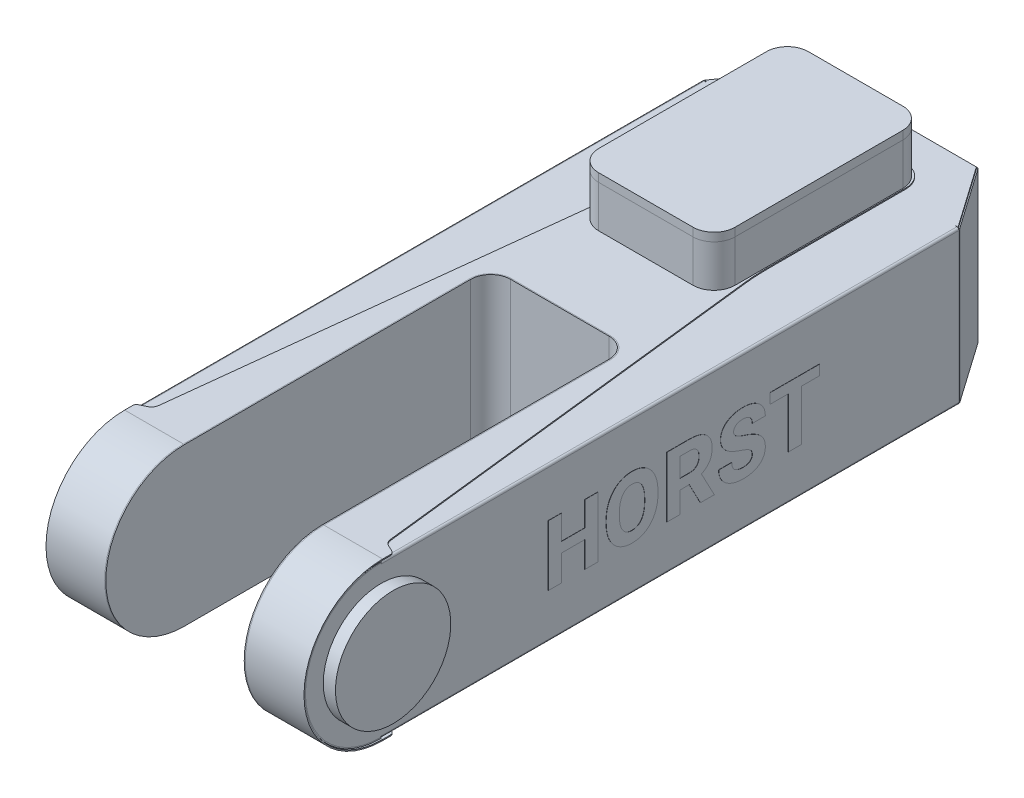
SolidWorks part; units mm, degrees
ref_plane "Ebene vorne" through (0, 0, 0) normal (0, 0, 1) x (1, 0, 0)
ref_plane "Ebene oben" through (0, 0, 0) normal (0, 1, 0) x (1, 0, 0)
ref_plane "Ebene rechts" through (0, 0, 0) normal (1, 0, 0) x (0, 0, -1)
imported_body "Zusammenbau_Einheit82-1/Platte82-1-surface1"
imported_body "Zusammenbau_Einheit82-3/Platte82-1-surface1"
imported_body "Zusammenbau_Treiberbox3-1/Platte165-1-surface1"
imported_body "Zusammenbau_Treiberbox3-1/Abdeckung54-1-surface1"
imported_body "190911_009_B-1-surface1"
imported_body "190911_009_B-1-surface2"
imported_body "190911_010_B-1-surface1"
imported_body "190911_010_B-1-surface2"
imported_body "190911_011_B-1-surface1"
imported_body "190911_011_B-1-surface2"
imported_body "190911_012_B-1-surface1"
sketch "Skizze1" plane through (61.2, 0, 0) normal (1, 0, 0) x (0, 0, -1)
  line L0 (-146.1573, -50.7217) -> (-152.3183, -39.0842)
  line L1 (-157.906, -21.8883) -> (-168.7653, -21.8883)
  line L2 (-168.7653, -21.8883) -> (-168.7653, -50.7217)
  line L3 (-168.7653, -50.7217) -> (-162.5633, -50.7217)
  line L4 (-162.5633, -50.7217) -> (-162.5633, -40.6113)
  line L5 (-162.5633, -40.6113) -> (-158.0815, -40.6113)
  line L6 (-158.0815, -40.6113) -> (-152.7923, -50.7217)
  line L7 (-152.7923, -50.7217) -> (-146.1573, -50.7217)
  line L8 (-173.0365, -36.9369) -> (-173.0365, -35.6907)
  line L9 (-197.6982, -35.6907) -> (-197.6982, -36.9369)
  line L10 (-201.7294, -21.8883) -> (-207.9139, -21.8883)
  line L11 (-207.9139, -21.8883) -> (-207.9139, -33.5726)
  line L12 (-207.9139, -33.5726) -> (-219.1067, -33.5726)
  line L13 (-219.1067, -33.5726) -> (-219.1067, -21.8883)
  line L14 (-219.1067, -21.8883) -> (-225.3087, -21.8883)
  line L15 (-225.3087, -21.8883) -> (-225.3087, -50.7217)
  line L16 (-225.3087, -50.7217) -> (-219.1067, -50.7217)
  line L17 (-219.1067, -50.7217) -> (-219.1067, -38.3646)
  line L18 (-219.1067, -38.3646) -> (-207.9139, -38.3646)
  line L19 (-207.9139, -38.3646) -> (-207.9139, -50.7217)
  line L20 (-207.9139, -50.7217) -> (-201.7294, -50.7217)
  line L21 (-201.7294, -50.7217) -> (-201.7294, -21.8883)
  line L22 (-95.9388, -26.6803) -> (-95.9388, -21.8883)
  line L23 (-95.9388, -21.8883) -> (-119.518, -21.8883)
  line L24 (-119.518, -21.8883) -> (-119.518, -26.6803)
  line L25 (-119.518, -26.6803) -> (-110.8879, -26.6803)
  line L26 (-110.8879, -26.6803) -> (-110.8879, -50.7217)
  line L27 (-110.8879, -50.7217) -> (-104.7093, -50.7217)
  line L28 (-104.7093, -50.7217) -> (-104.7093, -26.6803)
  line L29 (-104.7093, -26.6803) -> (-95.9388, -26.6803)
  line L30 (-137.8314, -41.5826) -> (-144.051, -41.5826)
  line L31 (-128.0194, -30.3312) -> (-121.8409, -30.3312)
  line L32 (-162.5633, -26.6803) -> (-162.5633, -35.8194)
  line L33 (-157.906, -26.6803) -> (-162.5633, -26.6803)
  line L34 (-162.5633, -35.8194) -> (-157.906, -35.8194)
  line L35 (-179.3145, -36.9194) -> (-179.3145, -35.6556)
  line L36 (-191.4201, -35.6556) -> (-191.4201, -36.9194)
  spline S0 degree 3 poles (-152.3183, -39.0842) (-152.1183, -38.9849) (-151.7226, -38.7883) (-151.1568, -38.462) (-150.6262, -38.1096) (-150.133, -37.7287) (-149.6775, -37.318) (-149.2542, -36.8866) (-148.8722, -36.4244) (-148.5194, -35.9408) (-148.2056, -35.4213) (-147.9392, -34.8655) (-147.7086, -34.2755) (-147.5208, -33.6497) (-147.385, -32.9851) (-147.2758, -32.2885) (-147.2208, -31.5549) (-147.2101, -31.0549) (-147.2046, -30.7993) knots 0 0 0 0 0.064592 0.127782 0.188807 0.248729 0.307857 0.366106 0.423388 0.481169 0.539125 0.598674 0.65923 0.722238 0.787412 0.855312 0.926059 1 1 1 1
  spline S1 degree 3 poles (-147.2046, -30.7993) (-147.2068, -30.5651) (-147.2111, -30.1035) (-147.2805, -29.4259) (-147.3776, -28.7728) (-147.5158, -28.1481) (-147.7017, -27.5538) (-147.9131, -26.9826) (-148.1822, -26.4449) (-148.4774, -25.9269) (-148.8182, -25.4446) (-149.188, -24.9874) (-149.6019, -24.5678) (-150.0412, -24.1695) (-150.5238, -23.8096) (-151.0367, -23.4789) (-151.5829, -23.1697) (-152.3746, -22.8124) (-153.4398, -22.426) (-154.8282, -22.1192) (-156.3283, -21.9216) (-157.369, -21.8997) (-157.906, -21.8883) knots 0 0 0 0 0.044443 0.087583 0.129159 0.169759 0.208875 0.247312 0.28523 0.322887 0.360377 0.397211 0.43439 0.472148 0.50969 0.548509 0.587958 0.628711 0.713264 0.802537 0.898103 1 1 1 1
  spline S2 degree 3 poles (-173.0365, -35.6907) (-173.0404, -35.3375) (-173.048, -34.6401) (-173.1271, -33.6131) (-173.2492, -32.6191) (-173.4187, -31.6601) (-173.6328, -30.7328) (-173.9042, -29.8429) (-174.2182, -28.9852) (-174.5878, -28.168) (-174.9986, -27.3899) (-175.4395, -26.651) (-175.9277, -25.9631) (-176.4578, -25.3256) (-177.0162, -24.7247) (-177.6254, -24.1802) (-178.2656, -23.6756) (-178.9475, -23.2268) (-179.6555, -22.8213) (-180.3935, -22.4676) (-181.1633, -22.1794) (-181.9526, -21.929) (-182.7711, -21.744) (-183.615, -21.6074) (-184.4874, -21.5336) (-185.0776, -21.5205) (-185.3761, -21.5139) knots 0 0 0 0 0.050066 0.098869 0.145963 0.192019 0.236894 0.28081 0.323858 0.366312 0.407875 0.448566 0.488236 0.527326 0.566061 0.604437 0.643049 0.681551 0.720071 0.758663 0.797439 0.836536 0.87598 0.916307 0.957667 1 1 1 1
  spline S3 degree 3 poles (-185.3761, -21.5139) (-185.6746, -21.5204) (-186.2629, -21.5334) (-187.1333, -21.6078) (-187.977, -21.7448) (-188.7978, -21.9282) (-189.5874, -22.1781) (-190.3543, -22.4691) (-191.091, -22.8211) (-191.7986, -23.2271) (-192.4802, -23.6737) (-193.1156, -24.1822) (-193.7242, -24.7246) (-194.283, -25.3238) (-194.8068, -25.9649) (-195.2946, -26.6524) (-195.7425, -27.3883) (-196.1536, -28.1668) (-196.5151, -28.9867) (-196.8307, -29.8427) (-197.1024, -30.7328) (-197.3136, -31.6608) (-197.4954, -32.6179) (-197.6047, -33.6137) (-197.6874, -34.64) (-197.6945, -35.3375) (-197.6982, -35.6907) knots 0 0 0 0 0.042359 0.083469 0.12382 0.163558 0.202679 0.24122 0.279836 0.318379 0.356905 0.395323 0.433723 0.472481 0.511419 0.551113 0.591973 0.633561 0.675929 0.719003 0.762946 0.807848 0.853981 0.901071 0.949904 1 1 1 1
  spline S4 degree 3 poles (-197.6982, -36.9369) (-197.6945, -37.2901) (-197.6873, -37.9876) (-197.6048, -39.0139) (-197.4953, -40.0097) (-197.3144, -40.965) (-197.1014, -41.8907) (-196.8308, -42.7791) (-196.5152, -43.6351) (-196.1533, -44.4548) (-195.7443, -45.2326) (-195.2926, -45.9642) (-194.8069, -46.6526) (-194.279, -47.2923) (-193.7104, -47.8834) (-193.104, -48.4304) (-192.4629, -48.9341) (-191.7803, -49.3849) (-191.0673, -49.7889) (-190.3248, -50.1406) (-189.5551, -50.433) (-188.7607, -50.6724) (-187.943, -50.8677) (-187.0961, -51.002) (-186.2239, -51.0766) (-185.6337, -51.0896) (-185.3351, -51.0962) knots 0 0 0 0 0.050052 0.098842 0.14589 0.191982 0.236576 0.28048 0.323516 0.365846 0.407398 0.447986 0.487644 0.526723 0.565438 0.603804 0.642405 0.680897 0.719646 0.758478 0.797243 0.836249 0.876014 0.916329 0.957679 1 1 1 1
  spline S5 degree 3 poles (-185.3351, -51.0962) (-185.0366, -51.0897) (-184.4483, -51.0769) (-183.5781, -51.0016) (-182.7332, -50.8676) (-181.9171, -50.6733) (-181.1268, -50.4329) (-180.363, -50.1405) (-179.6261, -49.7891) (-178.9184, -49.383) (-178.2371, -48.936) (-177.6015, -48.43) (-177.0003, -47.8836) (-176.4384, -47.2902) (-175.9096, -46.6544) (-175.4303, -45.9639) (-174.9852, -45.231) (-174.575, -44.4551) (-174.2144, -43.6349) (-173.8955, -42.7803) (-173.6375, -41.8886) (-173.4099, -40.9669) (-173.2422, -40.0088) (-173.1291, -39.0141) (-173.0475, -37.9875) (-173.0402, -37.2901) (-173.0365, -36.9369) knots 0 0 0 0 0.042418 0.083585 0.123992 0.163848 0.202677 0.241271 0.279941 0.318537 0.357117 0.395588 0.433836 0.472447 0.511615 0.551204 0.59174 0.633386 0.675812 0.718946 0.762871 0.80763 0.853778 0.900933 0.949834 1 1 1 1
  spline S6 degree 3 poles (-133.5076, -38.7741) (-133.1517, -38.8924) (-132.4813, -39.1154) (-131.5534, -39.4672) (-130.7577, -39.7939) (-130.099, -40.1267) (-129.5505, -40.4491) (-129.1012, -40.7759) (-128.7409, -41.111) (-128.4688, -41.4656) (-128.2694, -41.8458) (-128.136, -42.2636) (-128.0538, -42.7203) (-128.0427, -43.0391) (-128.037, -43.2033) knots 0 0 0 0 0.14792 0.278663 0.391401 0.48705 0.569512 0.642139 0.705808 0.762895 0.817609 0.874295 0.935262 1 1 1 1
  spline S7 degree 3 poles (-128.037, -43.2033) (-128.0474, -43.4255) (-128.0677, -43.8588) (-128.2843, -44.4696) (-128.6273, -45.0144) (-129.1114, -45.4788) (-129.7247, -45.8601) (-130.4765, -46.1156) (-131.3472, -46.2809) (-131.9718, -46.2962) (-132.3023, -46.3043) knots 0 0 0 0 0.111853 0.218094 0.323048 0.434518 0.553986 0.684872 0.833267 1 1 1 1
  spline S8 degree 3 poles (-132.3023, -46.3043) (-132.5189, -46.3011) (-132.9391, -46.295) (-133.5489, -46.2416) (-134.1202, -46.1556) (-134.6528, -46.0301) (-135.152, -45.8852) (-135.6047, -45.6857) (-136.026, -45.4657) (-136.4055, -45.2029) (-136.7462, -44.9006) (-137.0392, -44.5536) (-137.287, -44.1639) (-137.4863, -43.7301) (-137.6441, -43.2555) (-137.7546, -42.7356) (-137.8174, -42.1731) (-137.8267, -41.7836) (-137.8314, -41.5826) knots 0 0 0 0 0.077818 0.150975 0.219762 0.285212 0.347505 0.406214 0.46265 0.518054 0.571656 0.625855 0.680679 0.737115 0.796952 0.860044 0.927762 1 1 1 1
  spline S9 degree 3 poles (-144.051, -41.5826) (-144.0478, -41.8383) (-144.0415, -42.3415) (-143.9534, -43.078) (-143.8304, -43.7861) (-143.6372, -44.4609) (-143.4075, -45.1109) (-143.1195, -45.7281) (-142.7759, -46.3118) (-142.3854, -46.8648) (-141.9515, -47.3858) (-141.4822, -47.8706) (-140.9843, -48.3253) (-140.4489, -48.736) (-139.8949, -49.1294) (-139.2987, -49.4696) (-138.6799, -49.7914) (-137.8019, -50.1511) (-136.6654, -50.5371) (-135.2486, -50.8519) (-133.7909, -51.0626) (-132.8023, -51.0849) (-132.3023, -51.0962) knots 0 0 0 0 0.045229 0.088979 0.131081 0.172275 0.212993 0.252979 0.292576 0.332693 0.372637 0.412419 0.451999 0.491831 0.53175 0.572117 0.61317 0.655087 0.739881 0.825188 0.911573 1 1 1 1
  spline S10 degree 3 poles (-132.3023, -51.0962) (-131.7888, -51.0863) (-130.7934, -51.0672) (-129.352, -50.8808) (-128.0122, -50.5875) (-126.9704, -50.2371) (-126.1963, -49.9006) (-125.6574, -49.6165) (-125.1463, -49.3148) (-124.6707, -48.9804) (-124.2325, -48.6165) (-123.8246, -48.2302) (-123.4582, -47.8111) (-123.1137, -47.3749) (-122.8203, -46.9042) (-122.5509, -46.4198) (-122.3376, -45.9054) (-122.1538, -45.3729) (-122.0141, -44.8168) (-121.917, -44.2395) (-121.8472, -43.6418) (-121.843, -43.2347) (-121.8409, -43.0277) knots 0 0 0 0 0.103406 0.200432 0.292226 0.379322 0.421369 0.462139 0.501961 0.540876 0.579108 0.616623 0.653917 0.691167 0.728442 0.765537 0.802682 0.840453 0.87895 0.918029 0.958337 1 1 1 1
  spline S11 degree 3 poles (-121.8409, -43.0277) (-121.847, -42.7427) (-121.8591, -42.1819) (-121.9716, -41.3622) (-122.1609, -40.5829) (-122.4181, -39.8434) (-122.7472, -39.1388) (-123.1578, -38.4787) (-123.6436, -37.86) (-124.1984, -37.2767) (-124.8305, -36.7248) (-125.5388, -36.1987) (-126.3289, -35.7034) (-127.1891, -35.2228) (-128.129, -34.7667) (-129.1462, -34.3346) (-130.2436, -33.9325) (-131.0045, -33.6871) (-131.3954, -33.5609) knots 0 0 0 0 0.058728 0.115511 0.1701 0.223739 0.276597 0.330021 0.383565 0.438433 0.495675 0.556283 0.62006 0.687711 0.759251 0.835245 0.915355 1 1 1 1
  spline S12 degree 3 poles (-131.3954, -33.5609) (-131.6262, -33.4886) (-132.0741, -33.3482) (-132.7165, -33.1144) (-133.3195, -32.899) (-133.87, -32.6679) (-134.3738, -32.4406) (-134.834, -32.2128) (-135.2445, -31.98) (-135.6158, -31.7515) (-135.9363, -31.5122) (-136.2181, -31.265) (-136.4518, -31.0003) (-136.6483, -30.7258) (-136.7971, -30.4335) (-136.9007, -30.1299) (-136.9693, -29.8135) (-136.9784, -29.5983) (-136.9831, -29.4887) knots 0 0 0 0 0.098529 0.191289 0.278547 0.359433 0.434485 0.503797 0.568566 0.626782 0.681305 0.731403 0.779256 0.8249 0.868621 0.912356 0.955378 1 1 1 1
  spline S13 degree 3 poles (-136.9831, -29.4887) (-136.9789, -29.3417) (-136.9707, -29.0519) (-136.8617, -28.6343) (-136.7124, -28.2321) (-136.4857, -27.8599) (-136.2055, -27.5097) (-135.8545, -27.2052) (-135.444, -26.9397) (-134.9739, -26.7138) (-134.448, -26.5235) (-133.863, -26.4017) (-133.2294, -26.3143) (-132.7883, -26.3087) (-132.5598, -26.3058) knots 0 0 0 0 0.072036 0.142002 0.210877 0.282208 0.355099 0.430468 0.509414 0.594707 0.686249 0.78344 0.887808 1 1 1 1
  spline S14 degree 3 poles (-132.5598, -26.3058) (-132.3802, -26.3088) (-132.0299, -26.3146) (-131.5221, -26.3707) (-131.0447, -26.4468) (-130.6056, -26.5731) (-130.197, -26.7242) (-129.8213, -26.911) (-129.4792, -27.1344) (-129.1733, -27.3927) (-128.9073, -27.6826) (-128.6601, -27.9851) (-128.4659, -28.3219) (-128.2953, -28.6755) (-128.178, -29.0595) (-128.0811, -29.4612) (-128.0291, -29.8891) (-128.0227, -30.1809) (-128.0194, -30.3312) knots 0 0 0 0 0.078199 0.152503 0.222335 0.288501 0.351143 0.41193 0.470837 0.528705 0.585801 0.642057 0.698441 0.75469 0.81272 0.872894 0.934536 1 1 1 1
  spline S15 degree 3 poles (-121.8409, -30.3312) (-121.8464, -30.1186) (-121.8573, -29.6983) (-121.9132, -29.0757) (-122.0218, -28.4747) (-122.1602, -27.8886) (-122.3475, -27.3234) (-122.5791, -26.7751) (-122.8451, -26.243) (-123.16, -25.7344) (-123.499, -25.2408) (-123.8915, -24.7865) (-124.3052, -24.3525) (-124.752, -23.944) (-125.2411, -23.572) (-125.7582, -23.2198) (-126.3143, -22.9043) (-127.0967, -22.5112) (-128.1488, -22.1031) (-129.4982, -21.7601) (-130.9404, -21.5529) (-131.933, -21.5271) (-132.4427, -21.5139) knots 0 0 0 0 0.041237 0.08149 0.121022 0.159534 0.198151 0.236278 0.274828 0.313343 0.352151 0.390781 0.429553 0.468362 0.507987 0.548567 0.589552 0.631821 0.718248 0.807653 0.90122 1 1 1 1
  spline S16 degree 3 poles (-132.4427, -21.5139) (-132.9485, -21.5261) (-133.9343, -21.5499) (-135.3711, -21.7395) (-136.7221, -22.0536) (-137.9795, -22.491) (-139.1326, -23.0367) (-140.1574, -23.7005) (-141.0529, -24.4682) (-141.6889, -25.1939) (-142.1189, -25.8203) (-142.4021, -26.3057) (-142.6359, -26.8122) (-142.8293, -27.3346) (-142.9846, -27.8757) (-143.0859, -28.4365) (-143.1534, -29.0131) (-143.1628, -29.4027) (-143.1675, -29.5999) knots 0 0 0 0 0.101049 0.196975 0.289067 0.377827 0.46256 0.543433 0.621102 0.697631 0.735474 0.772848 0.809819 0.84682 0.884086 0.922159 0.960599 1 1 1 1
  spline S17 degree 3 poles (-143.1675, -29.5999) (-143.1656, -29.7971) (-143.1618, -30.1849) (-143.0886, -30.7543) (-143.0028, -31.3082) (-142.8572, -31.8382) (-142.6868, -32.3526) (-142.457, -32.8361) (-142.2093, -33.3112) (-141.8072, -33.9069) (-141.2318, -34.6096) (-140.4341, -35.372) (-139.5381, -36.0693) (-138.5279, -36.6869) (-137.4149, -37.2502) (-136.2051, -37.7884) (-134.8949, -38.3031) (-133.979, -38.6141) (-133.5076, -38.7741) knots 0 0 0 0 0.041169 0.080944 0.119795 0.158139 0.195635 0.232828 0.269833 0.307463 0.382744 0.459105 0.537507 0.619479 0.706035 0.797957 0.896014 1 1 1 1
  spline S18 degree 3 poles (-153.4008, -31.2732) (-153.4039, -31.0976) (-153.4101, -30.7552) (-153.4638, -30.2563) (-153.55, -29.7883) (-153.6728, -29.3484) (-153.8371, -28.9422) (-154.0313, -28.5598) (-154.2646, -28.2116) (-154.5312, -27.8921) (-154.8284, -27.6008) (-155.1719, -27.3586) (-155.5418, -27.1433) (-155.9504, -26.976) (-156.3904, -26.8391) (-156.8656, -26.75) (-157.3738, -26.6874) (-157.7244, -26.6827) (-157.906, -26.6803) knots 0 0 0 0 0.071809 0.139969 0.204876 0.266216 0.326336 0.383756 0.44126 0.497313 0.553712 0.610816 0.668678 0.728363 0.790919 0.856759 0.9258 1 1 1 1
  spline S19 degree 3 poles (-157.906, -35.8194) (-157.7264, -35.8168) (-157.3778, -35.8119) (-156.8732, -35.7505) (-156.4005, -35.6591) (-155.9629, -35.526) (-155.5591, -35.3515) (-155.1831, -35.152) (-154.8455, -34.9003) (-154.543, -34.614) (-154.2703, -34.2956) (-154.0372, -33.9456) (-153.8444, -33.5647) (-153.678, -33.1633) (-153.5576, -32.7283) (-153.4622, -32.2695) (-153.4106, -31.7795) (-153.4041, -31.445) (-153.4008, -31.2732) knots 0 0 0 0 0.073911 0.14343 0.208938 0.271928 0.331287 0.389858 0.446709 0.50408 0.561038 0.61894 0.676758 0.73655 0.797542 0.862263 0.929299 1 1 1 1
  spline S20 degree 3 poles (-179.3145, -35.6556) (-179.3183, -35.3063) (-179.3255, -34.6264) (-179.4034, -33.6401) (-179.5253, -32.716) (-179.6917, -31.8546) (-179.9129, -31.0556) (-180.1883, -30.3219) (-180.5095, -29.6509) (-180.8792, -29.0445) (-181.2925, -28.5043) (-181.7532, -28.0373) (-182.254, -27.6416) (-182.798, -27.3152) (-183.3856, -27.0654) (-184.0131, -26.8804) (-184.6822, -26.7761) (-185.1417, -26.763) (-185.3761, -26.7563) knots 0 0 0 0 0.086231 0.167864 0.244151 0.316313 0.384322 0.448639 0.509599 0.567749 0.623718 0.677186 0.729312 0.780935 0.83336 0.88655 0.942134 1 1 1 1
  spline S21 degree 3 poles (-185.3761, -26.7563) (-185.6124, -26.7629) (-186.0739, -26.7757) (-186.7468, -26.8809) (-187.3752, -27.0658) (-187.9674, -27.308) (-188.5094, -27.6364) (-189.0128, -28.0312) (-189.4675, -28.5023) (-189.8809, -29.0393) (-190.2426, -29.6455) (-190.5564, -30.3148) (-190.8298, -31.0455) (-191.0388, -31.8448) (-191.2204, -32.7047) (-191.3277, -33.633) (-191.4102, -34.6224) (-191.4167, -35.3043) (-191.4201, -35.6556) knots 0 0 0 0 0.058335 0.113908 0.167548 0.219774 0.271386 0.323501 0.377302 0.432584 0.490472 0.551211 0.614895 0.682762 0.755003 0.83169 0.913306 1 1 1 1
  spline S22 degree 3 poles (-191.4201, -36.9194) (-191.4165, -37.2667) (-191.4095, -37.9428) (-191.3294, -38.9268) (-191.2134, -39.8504) (-191.0325, -40.7086) (-190.823, -41.5104) (-190.5458, -42.247) (-190.2252, -42.9239) (-189.8556, -43.5362) (-189.442, -44.0819) (-188.9812, -44.5569) (-188.4746, -44.9565) (-187.9289, -45.2866) (-187.3403, -45.5417) (-186.709, -45.7215) (-186.0356, -45.8361) (-185.5716, -45.8478) (-185.3351, -45.8537) knots 0 0 0 0 0.085457 0.166333 0.242836 0.314376 0.382024 0.446571 0.507756 0.566118 0.622276 0.675905 0.728527 0.780632 0.832438 0.885907 0.941852 1 1 1 1
  spline S23 degree 3 poles (-185.3351, -45.8537) (-185.1006, -45.8478) (-184.6406, -45.836) (-183.9728, -45.7219) (-183.3463, -45.54) (-182.7609, -45.2899) (-182.224, -44.9542) (-181.7239, -44.557) (-181.2688, -44.0818) (-180.8623, -43.5343) (-180.4908, -42.9255) (-180.1772, -42.2466) (-179.9075, -41.5092) (-179.6941, -40.7095) (-179.5235, -39.8496) (-179.4045, -38.9269) (-179.3253, -37.9427) (-179.3182, -37.2667) (-179.3145, -36.9194) knots 0 0 0 0 0.057883 0.11356 0.166765 0.218764 0.270239 0.32268 0.376172 0.432248 0.490827 0.552032 0.616652 0.684552 0.756263 0.833049 0.914226 1 1 1 1
  point P61 (0, 0)
extrude "Aufsatz-Linear austragen1" add sketch "Skizze1" along normal blind 0.1
sketch "Skizze2" plane through (-61.2, 0, 0) normal (-1, 0, 0) x (0, 0, 1)
  line L0 (180.3852, -50.7827) -> (174.2241, -39.1452)
  line L1 (168.6365, -21.9493) -> (157.7772, -21.9493)
  line L2 (157.7772, -21.9493) -> (157.7772, -50.7827)
  line L3 (157.7772, -50.7827) -> (163.9792, -50.7827)
  line L4 (163.9792, -50.7827) -> (163.9792, -40.6723)
  line L5 (163.9792, -40.6723) -> (168.461, -40.6723)
  line L6 (168.461, -40.6723) -> (173.7502, -50.7827)
  line L7 (173.7502, -50.7827) -> (180.3852, -50.7827)
  line L8 (153.506, -36.9979) -> (153.506, -35.7517)
  line L9 (128.8443, -35.7517) -> (128.8443, -36.9979)
  line L10 (124.813, -21.9493) -> (118.6286, -21.9493)
  line L11 (118.6286, -21.9493) -> (118.6286, -33.6336)
  line L12 (118.6286, -33.6336) -> (107.4358, -33.6336)
  line L13 (107.4358, -33.6336) -> (107.4358, -21.9493)
  line L14 (107.4358, -21.9493) -> (101.2338, -21.9493)
  line L15 (101.2338, -21.9493) -> (101.2338, -50.7827)
  line L16 (101.2338, -50.7827) -> (107.4358, -50.7827)
  line L17 (107.4358, -50.7827) -> (107.4358, -38.4255)
  line L18 (107.4358, -38.4255) -> (118.6286, -38.4255)
  line L19 (118.6286, -38.4255) -> (118.6286, -50.7827)
  line L20 (118.6286, -50.7827) -> (124.813, -50.7827)
  line L21 (124.813, -50.7827) -> (124.813, -21.9493)
  line L22 (230.6037, -26.7412) -> (230.6037, -21.9493)
  line L23 (230.6037, -21.9493) -> (207.0245, -21.9493)
  line L24 (207.0245, -21.9493) -> (207.0245, -26.7412)
  line L25 (207.0245, -26.7412) -> (215.6546, -26.7412)
  line L26 (215.6546, -26.7412) -> (215.6546, -50.7827)
  line L27 (215.6546, -50.7827) -> (221.8332, -50.7827)
  line L28 (221.8332, -50.7827) -> (221.8332, -26.7412)
  line L29 (221.8332, -26.7412) -> (230.6037, -26.7412)
  line L30 (188.711, -41.6436) -> (182.4915, -41.6436)
  line L31 (198.5231, -30.3922) -> (204.7016, -30.3922)
  line L32 (163.9792, -26.7412) -> (163.9792, -35.8804)
  line L33 (168.6365, -26.7412) -> (163.9792, -26.7412)
  line L34 (163.9792, -35.8804) -> (168.6365, -35.8804)
  line L35 (147.228, -36.9804) -> (147.228, -35.7166)
  line L36 (135.1224, -35.7166) -> (135.1224, -36.9804)
  spline S0 degree 3 poles (174.2241, -39.1452) (174.4242, -39.0459) (174.8198, -38.8493) (175.3857, -38.523) (175.9163, -38.1705) (176.4095, -37.7897) (176.865, -37.379) (177.2883, -36.9476) (177.6703, -36.4854) (178.0231, -36.0018) (178.3369, -35.4823) (178.6033, -34.9265) (178.8339, -34.3365) (179.0217, -33.7106) (179.1575, -33.046) (179.2667, -32.3495) (179.3217, -31.6159) (179.3324, -31.1159) (179.3379, -30.8603) knots 0 0 0 0 0.064592 0.127782 0.188807 0.248729 0.307857 0.366106 0.423388 0.481169 0.539125 0.598674 0.65923 0.722238 0.787412 0.855312 0.926059 1 1 1 1
  spline S1 degree 3 poles (179.3379, -30.8603) (179.3357, -30.6261) (179.3314, -30.1645) (179.262, -29.4869) (179.1649, -28.8338) (179.0267, -28.2091) (178.8408, -27.6148) (178.6294, -27.0436) (178.3603, -26.5058) (178.0651, -25.9879) (177.7243, -25.5056) (177.3545, -25.0484) (176.9406, -24.6288) (176.5013, -24.2304) (176.0187, -23.8706) (175.5058, -23.5399) (174.9596, -23.2307) (174.1679, -22.8734) (173.1027, -22.487) (171.7143, -22.1802) (170.2142, -21.9826) (169.1735, -21.9606) (168.6365, -21.9493) knots 0 0 0 0 0.044443 0.087583 0.129159 0.169759 0.208875 0.247312 0.28523 0.322887 0.360377 0.397211 0.43439 0.472148 0.50969 0.548509 0.587958 0.628711 0.713264 0.802537 0.898103 1 1 1 1
  spline S2 degree 3 poles (153.506, -35.7517) (153.5021, -35.3985) (153.4945, -34.7011) (153.4153, -33.6741) (153.2933, -32.6801) (153.1238, -31.7211) (152.9097, -30.7938) (152.6383, -29.9039) (152.3243, -29.0462) (151.9546, -28.229) (151.5439, -27.4509) (151.103, -26.7119) (150.6148, -26.0241) (150.0847, -25.3866) (149.5263, -24.7856) (148.9171, -24.2412) (148.2769, -23.7366) (147.595, -23.2878) (146.887, -22.8823) (146.149, -22.5286) (145.3792, -22.2403) (144.5899, -21.99) (143.7714, -21.805) (142.9275, -21.6684) (142.0551, -21.5946) (141.4649, -21.5815) (141.1664, -21.5749) knots 0 0 0 0 0.050066 0.098869 0.145963 0.192019 0.236894 0.28081 0.323858 0.366312 0.407875 0.448566 0.488236 0.527326 0.566061 0.604437 0.643049 0.681551 0.720071 0.758663 0.797439 0.836536 0.87598 0.916307 0.957667 1 1 1 1
  spline S3 degree 3 poles (141.1664, -21.5749) (140.8679, -21.5814) (140.2796, -21.5943) (139.4092, -21.6687) (138.5654, -21.8058) (137.7447, -21.9892) (136.955, -22.2391) (136.1882, -22.5301) (135.4515, -22.8821) (134.7439, -23.2881) (134.0622, -23.7347) (133.4269, -24.2432) (132.8183, -24.7856) (132.2595, -25.3848) (131.7357, -26.0259) (131.2479, -26.7134) (130.8, -27.4493) (130.3889, -28.2278) (130.0274, -29.0477) (129.7117, -29.9037) (129.4401, -30.7938) (129.2289, -31.7218) (129.0471, -32.6789) (128.9377, -33.6747) (128.8551, -34.701) (128.848, -35.3985) (128.8443, -35.7517) knots 0 0 0 0 0.042359 0.083469 0.12382 0.163558 0.202679 0.24122 0.279836 0.318379 0.356905 0.395323 0.433723 0.472481 0.511419 0.551113 0.591973 0.633561 0.675929 0.719003 0.762946 0.807848 0.853981 0.901071 0.949904 1 1 1 1
  spline S4 degree 3 poles (128.8443, -36.9979) (128.848, -37.3511) (128.8551, -38.0486) (128.9377, -39.0749) (129.0472, -40.0707) (129.2281, -41.026) (129.4411, -41.9517) (129.7117, -42.84) (130.0273, -43.6961) (130.3892, -44.5158) (130.7982, -45.2936) (131.2499, -46.0252) (131.7355, -46.7136) (132.2635, -47.3532) (132.8321, -47.9444) (133.4385, -48.4914) (134.0796, -48.9951) (134.7622, -49.4459) (135.4752, -49.8498) (136.2177, -50.2016) (136.9874, -50.494) (137.7817, -50.7334) (138.5995, -50.9287) (139.4464, -51.063) (140.3186, -51.1376) (140.9088, -51.1506) (141.2074, -51.1572) knots 0 0 0 0 0.050052 0.098842 0.14589 0.191982 0.236576 0.28048 0.323516 0.365846 0.407398 0.447986 0.487644 0.526723 0.565438 0.603804 0.642405 0.680897 0.719646 0.758478 0.797243 0.836249 0.876014 0.916329 0.957679 1 1 1 1
  spline S5 degree 3 poles (141.2074, -51.1572) (141.5059, -51.1507) (142.0942, -51.1379) (142.9644, -51.0626) (143.8093, -50.9286) (144.6254, -50.7343) (145.4157, -50.4939) (146.1795, -50.2015) (146.9164, -49.8501) (147.6241, -49.444) (148.3053, -48.997) (148.941, -48.491) (149.5421, -47.9446) (150.1041, -47.3511) (150.6329, -46.7154) (151.1122, -46.0249) (151.5572, -45.292) (151.9675, -44.516) (152.3281, -43.6959) (152.647, -42.8413) (152.905, -41.9496) (153.1326, -41.0278) (153.3003, -40.0698) (153.4134, -39.0751) (153.495, -38.0485) (153.5023, -37.3511) (153.506, -36.9979) knots 0 0 0 0 0.042418 0.083585 0.123992 0.163848 0.202677 0.241271 0.279941 0.318537 0.357117 0.395588 0.433836 0.472447 0.511615 0.551204 0.59174 0.633386 0.675812 0.718946 0.762871 0.80763 0.853778 0.900933 0.949834 1 1 1 1
  spline S6 degree 3 poles (193.0349, -38.8351) (193.3908, -38.9534) (194.0612, -39.1764) (194.9891, -39.5282) (195.7848, -39.8549) (196.4435, -40.1877) (196.992, -40.5101) (197.4413, -40.8369) (197.8016, -41.1719) (198.0737, -41.5266) (198.2731, -41.9068) (198.4065, -42.3246) (198.4887, -42.7813) (198.4998, -43.1001) (198.5055, -43.2643) knots 0 0 0 0 0.14792 0.278663 0.391401 0.48705 0.569512 0.642139 0.705808 0.762895 0.817609 0.874295 0.935262 1 1 1 1
  spline S7 degree 3 poles (198.5055, -43.2643) (198.4951, -43.4865) (198.4748, -43.9198) (198.2582, -44.5306) (197.9152, -45.0754) (197.4311, -45.5398) (196.8178, -45.9211) (196.066, -46.1765) (195.1953, -46.3419) (194.5707, -46.3572) (194.2402, -46.3653) knots 0 0 0 0 0.111853 0.218094 0.323048 0.434518 0.553986 0.684872 0.833267 1 1 1 1
  spline S8 degree 3 poles (194.2402, -46.3653) (194.0236, -46.3621) (193.6033, -46.356) (192.9936, -46.3026) (192.4223, -46.2166) (191.8897, -46.0911) (191.3905, -45.9462) (190.9378, -45.7467) (190.5165, -45.5267) (190.137, -45.2639) (189.7963, -44.9616) (189.5033, -44.6146) (189.2555, -44.2249) (189.0562, -43.7911) (188.8984, -43.3165) (188.7879, -42.7966) (188.7251, -42.2341) (188.7158, -41.8446) (188.711, -41.6436) knots 0 0 0 0 0.077818 0.150975 0.219762 0.285212 0.347505 0.406214 0.46265 0.518054 0.571656 0.625855 0.680679 0.737115 0.796952 0.860044 0.927762 1 1 1 1
  spline S9 degree 3 poles (182.4915, -41.6436) (182.4947, -41.8993) (182.501, -42.4025) (182.5891, -43.139) (182.7121, -43.8471) (182.9053, -44.5219) (183.135, -45.1719) (183.423, -45.7891) (183.7666, -46.3728) (184.1571, -46.9258) (184.591, -47.4468) (185.0602, -47.9316) (185.5582, -48.3863) (186.0936, -48.797) (186.6476, -49.1904) (187.2437, -49.5306) (187.8626, -49.8524) (188.7406, -50.2121) (189.8771, -50.5981) (191.2939, -50.9129) (192.7516, -51.1236) (193.7401, -51.1459) (194.2402, -51.1572) knots 0 0 0 0 0.045229 0.088979 0.131081 0.172275 0.212993 0.252979 0.292576 0.332693 0.372637 0.412419 0.451999 0.491831 0.53175 0.572117 0.61317 0.655087 0.739881 0.825188 0.911573 1 1 1 1
  spline S10 degree 3 poles (194.2402, -51.1572) (194.7537, -51.1473) (195.7491, -51.1282) (197.1905, -50.9418) (198.5302, -50.6485) (199.5721, -50.2981) (200.3462, -49.9616) (200.8851, -49.6775) (201.3962, -49.3758) (201.8718, -49.0414) (202.31, -48.6775) (202.7179, -48.2912) (203.0843, -47.8721) (203.4288, -47.4359) (203.7222, -46.9652) (203.9916, -46.4808) (204.2049, -45.9664) (204.3887, -45.4339) (204.5284, -44.8778) (204.6255, -44.3005) (204.6953, -43.7028) (204.6995, -43.2957) (204.7016, -43.0887) knots 0 0 0 0 0.103406 0.200432 0.292226 0.379322 0.421369 0.462139 0.501961 0.540876 0.579108 0.616623 0.653917 0.691167 0.728442 0.765537 0.802682 0.840453 0.87895 0.918029 0.958337 1 1 1 1
  spline S11 degree 3 poles (204.7016, -43.0887) (204.6955, -42.8036) (204.6833, -42.2429) (204.5709, -41.4231) (204.3816, -40.6439) (204.1244, -39.9044) (203.7953, -39.1998) (203.3847, -38.5397) (202.8989, -37.921) (202.3441, -37.3377) (201.712, -36.7857) (201.0037, -36.2597) (200.2136, -35.7644) (199.3534, -35.2838) (198.4135, -34.8276) (197.3963, -34.3956) (196.2989, -33.9935) (195.538, -33.748) (195.1471, -33.6219) knots 0 0 0 0 0.058728 0.115511 0.1701 0.223739 0.276597 0.330021 0.383565 0.438433 0.495675 0.556283 0.62006 0.687711 0.759251 0.835245 0.915355 1 1 1 1
  spline S12 degree 3 poles (195.1471, -33.6219) (194.9163, -33.5496) (194.4684, -33.4092) (193.826, -33.1754) (193.223, -32.96) (192.6725, -32.7289) (192.1687, -32.5016) (191.7085, -32.2738) (191.298, -32.041) (190.9267, -31.8125) (190.6062, -31.5732) (190.3244, -31.326) (190.0907, -31.0613) (189.8942, -30.7868) (189.7454, -30.4945) (189.6418, -30.1909) (189.5732, -29.8745) (189.5641, -29.6593) (189.5594, -29.5497) knots 0 0 0 0 0.098529 0.191289 0.278547 0.359433 0.434485 0.503797 0.568566 0.626782 0.681305 0.731403 0.779256 0.8249 0.868621 0.912356 0.955378 1 1 1 1
  spline S13 degree 3 poles (189.5594, -29.5497) (189.5636, -29.4027) (189.5718, -29.1129) (189.6808, -28.6952) (189.8301, -28.2931) (190.0568, -27.9209) (190.337, -27.5707) (190.688, -27.2662) (191.0985, -27.0007) (191.5686, -26.7747) (192.0945, -26.5845) (192.6795, -26.4627) (193.3131, -26.3753) (193.7542, -26.3697) (193.9827, -26.3668) knots 0 0 0 0 0.072036 0.142002 0.210877 0.282208 0.355099 0.430468 0.509414 0.594707 0.686249 0.78344 0.887808 1 1 1 1
  spline S14 degree 3 poles (193.9827, -26.3668) (194.1623, -26.3698) (194.5126, -26.3756) (195.0204, -26.4317) (195.4978, -26.5078) (195.9369, -26.634) (196.3455, -26.7852) (196.7212, -26.972) (197.0633, -27.1954) (197.3692, -27.4537) (197.6352, -27.7436) (197.8824, -28.0461) (198.0766, -28.3829) (198.2472, -28.7365) (198.3645, -29.1205) (198.4614, -29.5222) (198.5133, -29.9501) (198.5198, -30.2419) (198.5231, -30.3922) knots 0 0 0 0 0.078199 0.152503 0.222335 0.288501 0.351143 0.41193 0.470837 0.528705 0.585801 0.642057 0.698441 0.75469 0.81272 0.872894 0.934536 1 1 1 1
  spline S15 degree 3 poles (204.7016, -30.3922) (204.6961, -30.1795) (204.6852, -29.7593) (204.6293, -29.1367) (204.5207, -28.5357) (204.3823, -27.9495) (204.195, -27.3844) (203.9634, -26.8361) (203.6974, -26.304) (203.3825, -25.7954) (203.0435, -25.3017) (202.651, -24.8475) (202.2373, -24.4134) (201.7905, -24.005) (201.3014, -23.633) (200.7843, -23.2808) (200.2282, -22.9653) (199.4458, -22.5722) (198.3937, -22.1641) (197.0443, -21.8211) (195.6021, -21.6139) (194.6095, -21.5881) (194.0998, -21.5749) knots 0 0 0 0 0.041237 0.08149 0.121022 0.159534 0.198151 0.236278 0.274828 0.313343 0.352151 0.390781 0.429553 0.468362 0.507987 0.548567 0.589552 0.631821 0.718248 0.807653 0.90122 1 1 1 1
  spline S16 degree 3 poles (194.0998, -21.5749) (193.594, -21.5871) (192.6082, -21.6109) (191.1714, -21.8005) (189.8204, -22.1146) (188.563, -22.552) (187.4099, -23.0976) (186.3851, -23.7614) (185.4896, -24.5292) (184.8536, -25.2548) (184.4236, -25.8813) (184.1404, -26.3667) (183.9065, -26.8732) (183.7132, -27.3956) (183.5579, -27.9366) (183.4566, -28.4975) (183.3891, -29.0741) (183.3797, -29.4637) (183.375, -29.6609) knots 0 0 0 0 0.101049 0.196975 0.289067 0.377827 0.46256 0.543433 0.621102 0.697631 0.735474 0.772848 0.809819 0.84682 0.884086 0.922159 0.960599 1 1 1 1
  spline S17 degree 3 poles (183.375, -29.6609) (183.3769, -29.8581) (183.3807, -30.2459) (183.4539, -30.8153) (183.5397, -31.3691) (183.6852, -31.8992) (183.8557, -32.4136) (184.0855, -32.8971) (184.3332, -33.3722) (184.7353, -33.9679) (185.3107, -34.6706) (186.1084, -35.433) (187.0043, -36.1303) (188.0146, -36.7479) (189.1276, -37.3112) (190.3374, -37.8494) (191.6476, -38.3641) (192.5635, -38.6751) (193.0349, -38.8351) knots 0 0 0 0 0.041169 0.080944 0.119795 0.158139 0.195635 0.232828 0.269833 0.307463 0.382744 0.459105 0.537507 0.619479 0.706035 0.797957 0.896014 1 1 1 1
  spline S18 degree 3 poles (173.1417, -31.3342) (173.1385, -31.1586) (173.1324, -30.8161) (173.0787, -30.3173) (172.9925, -29.8492) (172.8697, -29.4094) (172.7054, -29.0032) (172.5112, -28.6208) (172.2779, -28.2726) (172.0112, -27.9531) (171.7141, -27.6618) (171.3706, -27.4196) (171.0007, -27.2043) (170.5921, -27.037) (170.1521, -26.9001) (169.6769, -26.811) (169.1687, -26.7484) (168.8181, -26.7437) (168.6365, -26.7412) knots 0 0 0 0 0.071809 0.139969 0.204876 0.266216 0.326336 0.383756 0.44126 0.497313 0.553712 0.610816 0.668678 0.728363 0.790919 0.856759 0.9258 1 1 1 1
  spline S19 degree 3 poles (168.6365, -35.8804) (168.8161, -35.8778) (169.1647, -35.8728) (169.6693, -35.8115) (170.142, -35.7201) (170.5796, -35.587) (170.9834, -35.4125) (171.3593, -35.213) (171.697, -34.9613) (171.9995, -34.675) (172.2722, -34.3566) (172.5053, -34.0065) (172.6981, -33.6257) (172.8645, -33.2242) (172.9849, -32.7892) (173.0803, -32.3305) (173.1319, -31.8405) (173.1384, -31.506) (173.1417, -31.3342) knots 0 0 0 0 0.073911 0.14343 0.208938 0.271928 0.331287 0.389858 0.446709 0.50408 0.561038 0.61894 0.676758 0.73655 0.797542 0.862263 0.929299 1 1 1 1
  spline S20 degree 3 poles (147.228, -35.7166) (147.2242, -35.3673) (147.217, -34.6874) (147.1391, -33.701) (147.0172, -32.777) (146.8507, -31.9156) (146.6296, -31.1166) (146.3542, -30.3829) (146.033, -29.7119) (145.6633, -29.1054) (145.25, -28.5653) (144.7893, -28.0983) (144.2885, -27.7026) (143.7445, -27.3762) (143.1569, -27.1264) (142.5294, -26.9414) (141.8603, -26.8371) (141.4008, -26.824) (141.1664, -26.8173) knots 0 0 0 0 0.086231 0.167864 0.244151 0.316313 0.384322 0.448639 0.509599 0.567749 0.623718 0.677186 0.729312 0.780935 0.83336 0.88655 0.942134 1 1 1 1
  spline S21 degree 3 poles (141.1664, -26.8173) (140.9301, -26.8239) (140.4686, -26.8367) (139.7957, -26.9419) (139.1673, -27.1268) (138.5751, -27.369) (138.033, -27.6974) (137.5297, -28.0922) (137.075, -28.5633) (136.6616, -29.1003) (136.2999, -29.7065) (135.986, -30.3758) (135.7127, -31.1064) (135.5037, -31.9058) (135.3221, -32.7657) (135.2148, -33.694) (135.1323, -34.6834) (135.1258, -35.3653) (135.1224, -35.7166) knots 0 0 0 0 0.058335 0.113908 0.167548 0.219774 0.271386 0.323501 0.377302 0.432584 0.490472 0.551211 0.614895 0.682762 0.755003 0.83169 0.913306 1 1 1 1
  spline S22 degree 3 poles (135.1224, -36.9804) (135.126, -37.3277) (135.133, -38.0037) (135.213, -38.9878) (135.3291, -39.9114) (135.51, -40.7696) (135.7195, -41.5714) (135.9967, -42.308) (136.3172, -42.9849) (136.6869, -43.5972) (137.1005, -44.1429) (137.5613, -44.6179) (138.0679, -45.0175) (138.6135, -45.3476) (139.2022, -45.6026) (139.8335, -45.7825) (140.5069, -45.8971) (140.9709, -45.9088) (141.2074, -45.9147) knots 0 0 0 0 0.085457 0.166333 0.242836 0.314376 0.382024 0.446571 0.507756 0.566118 0.622276 0.675905 0.728527 0.780632 0.832438 0.885907 0.941852 1 1 1 1
  spline S23 degree 3 poles (141.2074, -45.9147) (141.4418, -45.9087) (141.9019, -45.897) (142.5697, -45.7829) (143.1962, -45.601) (143.7816, -45.3509) (144.3184, -45.0152) (144.8186, -44.6179) (145.2737, -44.1428) (145.6802, -43.5953) (146.0517, -42.9865) (146.3653, -42.3076) (146.6349, -41.5701) (146.8484, -40.7705) (147.019, -39.9106) (147.138, -38.9879) (147.2172, -38.0037) (147.2243, -37.3277) (147.228, -36.9804) knots 0 0 0 0 0.057883 0.11356 0.166765 0.218764 0.270239 0.32268 0.376172 0.432248 0.490827 0.552032 0.616652 0.684552 0.756263 0.833049 0.914226 1 1 1 1
extrude "Aufsatz-Linear austragen2" add sketch "Skizze2" along normal blind 0.1 separate body
